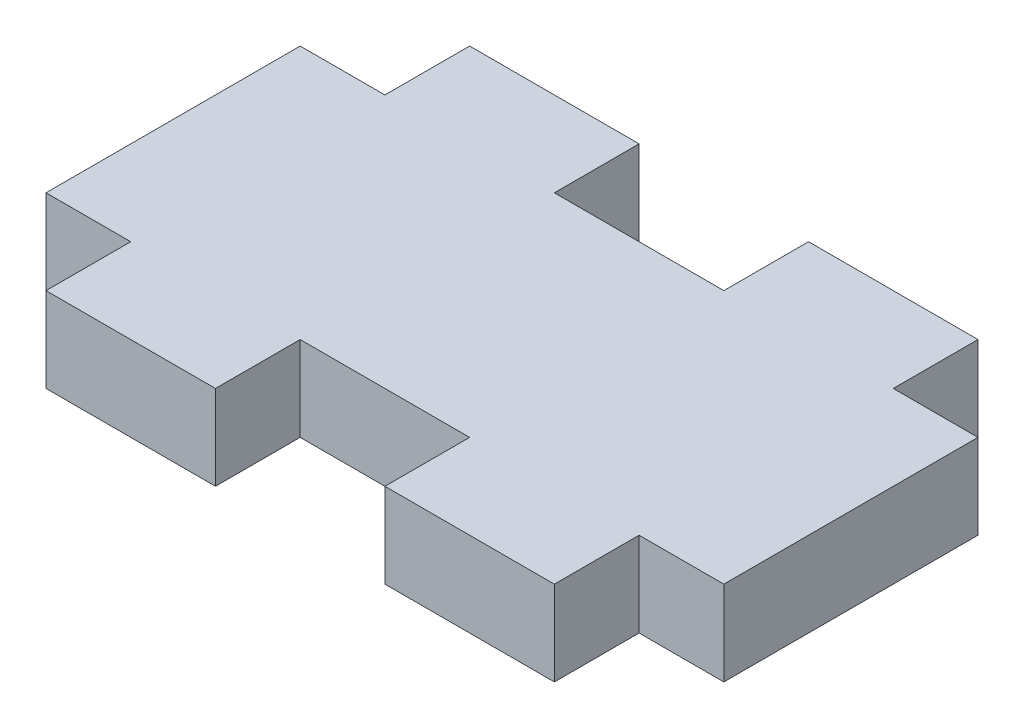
SolidWorks part; units mm, degrees
ref_plane "Front Plane" through (0, 0, 0) normal (0, 0, 1) x (1, 0, 0)
ref_plane "Top Plane" through (0, 0, 0) normal (0, 1, 0) x (1, 0, 0)
ref_plane "Right Plane" through (0, 0, 0) normal (1, 0, 0) x (0, 0, -1)
sketch "Sketch1" plane through (0, 0, 0) normal (0, 1, 0) x (1, 0, 0)
  line L1 (-25.4, 9.525) -> (25.4, 9.525)
  line L2 (-25.4, 9.525) -> (-25.4, -9.525)
  line L3 (-25.4, -9.525) -> (25.4, -9.525)
  line L4 (25.4, 9.525) -> (25.4, -9.525)
  line L5 (-25.4, 9.525) -> (25.4, -9.525) construction
  line L6 (-25.4, -9.525) -> (25.4, 9.525) construction
  point P0 (0, 0)
  dimension "D1" = 19.05
  dimension "D2" = 50.8
extrude "Boss-Extrude1" add sketch "Sketch1" along normal mid plane 6.35
sketch "Sketch2" plane through (0, 3.175, 0) normal (0, 1, 0) x (1, 0, 0)
  line L0 (25.4, 9.525) -> (-25.4, 9.525) construction
  line L1 (-19.05, 9.525) -> (-6.35, 9.525)
  line L2 (-19.05, 9.525) -> (-19.05, 15.875)
  line L3 (-19.05, 15.875) -> (-6.35, 15.875)
  line L4 (-6.35, 9.525) -> (-6.35, 15.875)
  line L5 (-6.35, 9.525) -> (6.35, 9.525) construction
  line L6 (6.35, 9.525) -> (19.05, 9.525)
  line L7 (6.35, 9.525) -> (6.35, 15.875)
  line L8 (6.35, 15.875) -> (19.05, 15.875)
  line L9 (19.05, 9.525) -> (19.05, 15.875)
  line L10 (0, 9.525) -> (0, 0) construction
  dimension "D1" = 12.7
  dimension "D2" = 25.4
  dimension "D3" = 6.35
extrude "Boss-Extrude2" add sketch "Sketch2" against normal up to surface (6.35 mm away)
mirror "Mirror1" about plane through (0, 0, 0) normal (0, 0, 1) of "Boss-Extrude2"
sketch "Sketch3" plane through (0, 3.175, 0) normal (0, 1, 0) x (1, 0, 0)
  line L40 (25.5016, -9.6266) -> (25.5016, 9.6266)
  line L41 (25.5016, 9.6266) -> (19.1516, 9.6266)
  line L42 (19.1516, 9.6266) -> (19.1516, 15.9766)
  line L43 (19.1516, 15.9766) -> (6.2484, 15.9766)
  line L44 (6.2484, 15.9766) -> (6.2484, 9.6266)
  line L45 (6.2484, 9.6266) -> (-6.2484, 9.6266)
  line L46 (-6.2484, 9.6266) -> (-6.2484, 15.9766)
  line L47 (-6.2484, 15.9766) -> (-19.1516, 15.9766)
  line L48 (-19.1516, 15.9766) -> (-19.1516, 9.6266)
  line L49 (-19.1516, 9.6266) -> (-25.5016, 9.6266)
  line L50 (-25.5016, 9.6266) -> (-25.5016, -9.6266)
  line L51 (-25.5016, -9.6266) -> (-19.1516, -9.6266)
  line L52 (-19.1516, -9.6266) -> (-19.1516, -15.9766)
  line L53 (-19.1516, -15.9766) -> (-6.2484, -15.9766)
  line L54 (-6.2484, -15.9766) -> (-6.2484, -9.6266)
  line L55 (-6.2484, -9.6266) -> (6.2484, -9.6266)
  line L56 (6.2484, -9.6266) -> (6.2484, -15.9766)
  line L57 (6.2484, -15.9766) -> (19.1516, -15.9766)
  line L58 (19.1516, -15.9766) -> (19.1516, -9.6266)
  line L59 (19.1516, -9.6266) -> (25.5016, -9.6266)
  line L60 (25.5016, -9.6266) -> (25.5016, 9.6266)
  line L61 (25.5016, 9.6266) -> (19.1516, 9.6266)
  line L62 (19.1516, 9.6266) -> (19.1516, 15.9766)
  line L63 (19.1516, 15.9766) -> (6.2484, 15.9766)
  line L64 (6.2484, 15.9766) -> (6.2484, 9.6266)
  line L65 (6.2484, 9.6266) -> (-6.2484, 9.6266)
  line L66 (-6.2484, 9.6266) -> (-6.2484, 15.9766)
  line L67 (-6.2484, 15.9766) -> (-19.1516, 15.9766)
  line L68 (-19.1516, 15.9766) -> (-19.1516, 9.6266)
  line L69 (-19.1516, 9.6266) -> (-25.5016, 9.6266)
  line L70 (-25.5016, 9.6266) -> (-25.5016, -9.6266)
  line L71 (-25.5016, -9.6266) -> (-19.1516, -9.6266)
  line L72 (-19.1516, -9.6266) -> (-19.1516, -15.9766)
  line L73 (-19.1516, -15.9766) -> (-6.2484, -15.9766)
  line L74 (-6.2484, -15.9766) -> (-6.2484, -9.6266)
  line L75 (-6.2484, -9.6266) -> (6.2484, -9.6266)
  line L76 (6.2484, -9.6266) -> (6.2484, -15.9766)
  line L77 (6.2484, -15.9766) -> (19.1516, -15.9766)
  line L78 (19.1516, -15.9766) -> (19.1516, -9.6266)
  line L79 (19.1516, -9.6266) -> (25.5016, -9.6266)
  dimension "D1" = 0.1016
